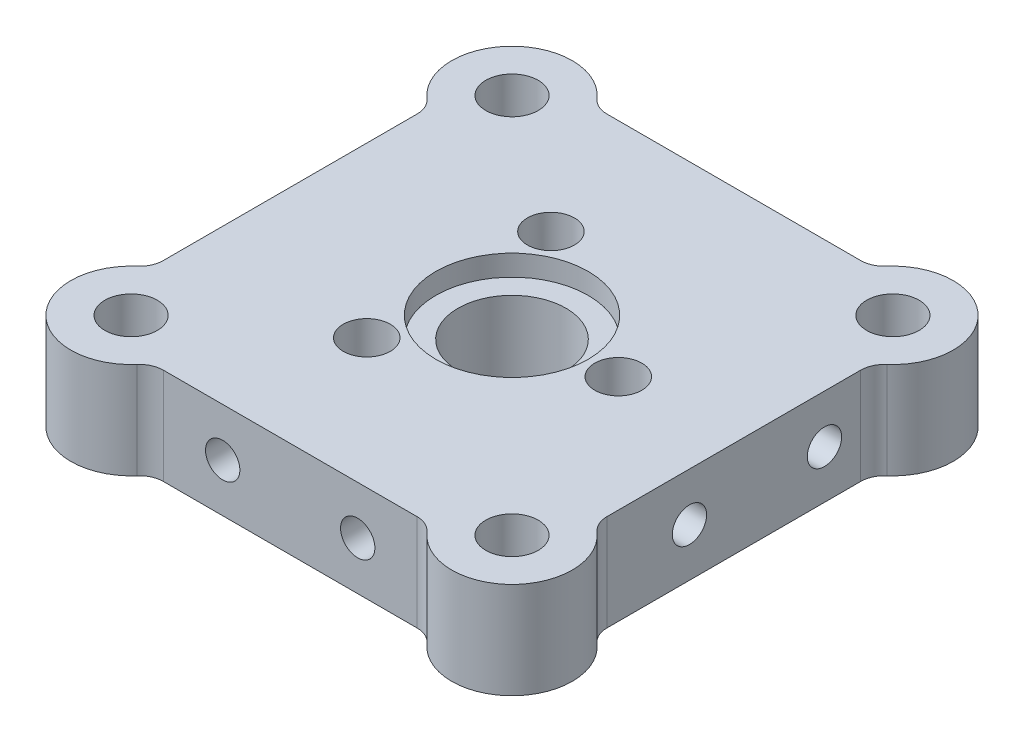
SolidWorks part; units mm, degrees
ref_plane "Front Plane" through (0, 0, 0) normal (0, 0, 1) x (1, 0, 0)
ref_plane "Top Plane" through (0, 0, 0) normal (0, 1, 0) x (1, 0, 0)
ref_plane "Right Plane" through (0, 0, 0) normal (1, 0, 0) x (0, 0, -1)
sketch "Sketch1" plane through (0, 0, 0) normal (0, 1, 0) x (0, 0, -1)
  line L0 (16.51, 16.51) -> (-16.51, -16.51) construction
  line L1 (16.51, 16.51) -> (-16.51, 16.51)
  line L2 (16.51, 12.5413) -> (16.51, -12.5413) construction
  line L3 (-16.51, -16.51) -> (16.51, -16.51)
  line L4 (16.51, 16.51) -> (16.51, -16.51)
  line L5 (-16.51, 16.51) -> (-16.51, -16.51)
  line L7 (12.5413, -16.51) -> (-12.5413, -16.51) construction
extrude "Extrude1" add sketch "Sketch1" along normal blind 6.35
sketch "Sketch3" plane through (0, 6.35, 0) normal (0, 1, 0) x (1, 0, 0)
  circle A0 centre (0, 0) radius 5.0165
  dimension "D1" = 10.033
extrude "Cut-Extrude2" cut sketch "Sketch3" against normal blind 1.3716
sketch "Sketch4" plane through (0, 4.9784, 0) normal (0, 1, 0) x (1, 0, 0)
  circle A0 centre (0, 0) radius 3.556
  dimension "D1" = 7.112
extrude "Cut-Extrude3" cut sketch "Sketch4" against normal up to next
fillet "Fillet1" radius 3.9688 4 edges at (16.51, 3.175, 16.51) (-16.51, 3.175, 16.51) (16.51, 3.175, -16.51) (-16.51, 3.175, -16.51)
sketch "Sketch21" plane through (0, 6.35, 0) normal (0, 1, 0) x (1, 0, 0)
  line L0 (16.51, -12.5412) -> (16.51, 12.5412)
  line L1 (12.5413, 16.51) -> (-12.5413, 16.51)
  line L2 (-16.51, 12.5412) -> (-16.51, -12.5412)
  line L3 (-12.5413, -16.51) -> (12.5413, -16.51)
  line L4 (-14.605, 0) -> (-16.51, 0) construction
  line L5 (14.605, 0) -> (16.51, 0) construction
  line L6 (0, 14.605) -> (0, 16.51) construction
  line L7 (0, -14.605) -> (0, -16.51) construction
  line L21 (8.3531, -14.605) -> (-8.3531, -14.605)
  line L22 (14.605, -8.3531) -> (14.605, 8.3531)
  line L23 (8.3531, 14.605) -> (-8.3531, 14.605)
  line L24 (-14.605, -8.3531) -> (-14.605, 8.3531)
  line L28 (-12.5413, -16.51) -> (12.5413, -16.51) construction
  arc A0 (16.51, -12.5412) -> (15.1493, -9.5497) centre (12.5413, -12.5412) ccw
  arc A1 (-12.5413, -16.51) -> (-9.5497, -15.1493) centre (-12.5413, -12.5412) ccw
  arc A2 (-16.51, 12.5412) -> (-15.1493, 9.5497) centre (-12.5413, 12.5412) ccw
  arc A3 (12.5413, 16.51) -> (9.5497, 15.1493) centre (12.5413, 12.5412) ccw
  arc A4 (15.1493, 9.5497) -> (14.605, 8.3531) centre (16.1925, 8.3531) ccw
  arc A5 (15.1493, -9.5497) -> (14.605, -8.3531) centre (16.1925, -8.3531) cw
  arc A6 (9.5497, -15.1493) -> (8.3531, -14.605) centre (8.3531, -16.1925) ccw
  arc A7 (-9.5497, -15.1493) -> (-8.3531, -14.605) centre (-8.3531, -16.1925) cw
  arc A8 (-15.1493, -9.5497) -> (-14.605, -8.3531) centre (-16.1925, -8.3531) ccw
  arc A9 (-15.1493, 9.5497) -> (-14.605, 8.3531) centre (-16.1925, 8.3531) cw
  arc A10 (-9.5497, 15.1493) -> (-8.3531, 14.605) centre (-8.3531, 16.1925) ccw
  arc A11 (9.5497, 15.1493) -> (8.3531, 14.605) centre (8.3531, 16.1925) cw
  arc A16 (9.5497, -15.1493) -> (12.5413, -16.51) centre (12.5413, -12.5412) ccw
  arc A17 (15.1493, 9.5497) -> (16.51, 12.5412) centre (12.5413, 12.5412) ccw
  arc A18 (-9.5497, 15.1493) -> (-12.5413, 16.51) centre (-12.5413, 12.5412) ccw
  arc A19 (-15.1493, -9.5497) -> (-16.51, -12.5412) centre (-12.5413, -12.5412) ccw
  arc A20 (12.5413, -16.51) -> (16.51, -12.5412) centre (12.5413, -12.5412) ccw construction
  arc A21 (16.51, 12.5412) -> (12.5413, 16.51) centre (12.5413, 12.5412) ccw construction
  arc A22 (-12.5413, 16.51) -> (-16.51, 12.5412) centre (-12.5413, 12.5412) ccw construction
  arc A23 (-16.51, -12.5412) -> (-12.5413, -16.51) centre (-12.5413, -12.5412) ccw construction
  dimension "D5" = 1.5875
  dimension "D4" = 1.905
extrude "Cut-Extrude4" cut sketch "Sketch21" against normal through all
hole_wizard "CBORE for M2.5 SHCS1" positions "Sketch6" profile "Sketch7" counterbore size "M2.5" standard "ANSI Metric"
sketch "Sketch6" plane through (3.175, 0, 0) normal (0, 1, 0) x (-1, 0, 0)
  circle A0 centre (-3.825, 0) radius 1.025 construction
  circle A1 centre (6.675, -6.0622) radius 1.025 construction
  circle A2 centre (6.675, 6.0622) radius 1.025 construction
  point P4 (-3.825, 0)
  point P10 (6.675, 6.0622)
  point P12 (6.675, -6.0622)
sketch "Sketch7" plane through (7, 0, 0) normal (1, 0, 0) x (0, 0, -1)
  line L0 (0, 0) -> (0, 6.35)
  line L1 (0, 6.35) -> (1.55, 6.35)
  line L3 (1.55, 6.35) -> (1.55, 3.516)
  line L4 (1.55, 3.516) -> (2.75, 3.516)
  line L5 (2.75, 3.516) -> (2.75, 0)
  line L7 (2.75, 0) -> (0, 0)
  line L11 (0, -6.35) -> (0, 107.95) construction
  dimension "Thru Hole Dia." = 3.1
  dimension "Thru Hole Depth" = 6.35
  dimension "C'Bore Dia." = 5.5
  dimension "C'Bore Depth" = 3.516
hole_wizard "#4-40 Tapped Hole1" positions "Sketch11" profile "Sketch12" tap size "#4-40" standard "ANSI Inch"
sketch "Sketch11" plane through (-14.605, 0, 0) normal (1, 0, 0) x (0, 0, -1)
  line L0 (-4.445, 3.175) -> (4.445, 3.175) construction
  line L10 (0, 0) -> (0, 6.35) construction
  line L12 (0, 3.175) -> (4.445, 3.175) construction
  line L14 (-8.3531, 6.35) -> (8.3531, 6.35) construction
  point P0 (-4.445, 3.175)
  point P2 (4.445, 3.175)
  dimension "D1" = 8.89
sketch "Sketch12" plane through (-14.605, 3.175, 4.445) normal (0, 1, 0) x (0, 0, 1)
  line L0 (0, 0) -> (0, 8.2738)
  line L1 (0, 8.2738) -> (1.1303, 7.5946)
  line L2 (1.1303, 7.5946) -> (1.1303, 0)
  line L5 (1.1303, 0) -> (0, 0)
  line L10 (0, 8.2738) -> (-1.1303, 7.5946) construction
  line L11 (0, -6.35) -> (0, 107.95) construction
  dimension "Tap Drill Dia." = 2.2606
  dimension "Tap Drill Depth" = 7.5946
  dimension "Drill Angle" = 118
hole_wizard "#4-40 Tapped Hole2" positions "Sketch13" profile "Sketch14" tap size "#4-40" standard "ANSI Inch"
sketch "Sketch13" plane through (0, 0, 14.605) normal (0, 0, -1) x (-1, 0, 0)
  line L1 (-4.445, 3.175) -> (4.445, 3.175) construction
  line L3 (0, 0) -> (0, 6.35) construction
  line L6 (-8.3531, 6.35) -> (8.3531, 6.35) construction
  line L7 (-8.3531, 0) -> (8.3531, 0) construction
  point P0 (4.445, 3.175)
  point P2 (-4.445, 3.175)
  point P34 (0, 3.175)
  dimension "D1" = 8.89
sketch "Sketch14" plane through (-4.445, 3.175, 14.605) normal (1, 0, 0) x (0, -1, 0)
  line L0 (0, 0) -> (0, 8.2738)
  line L1 (0, 8.2738) -> (1.1303, 7.5946)
  line L2 (1.1303, 7.5946) -> (1.1303, 0)
  line L5 (1.1303, 0) -> (0, 0)
  line L10 (0, 8.2738) -> (-1.1303, 7.5946) construction
  line L11 (0, -6.35) -> (0, 107.95) construction
  dimension "Tap Drill Dia." = 2.2606
  dimension "Tap Drill Depth" = 7.5946
  dimension "Drill Angle" = 118
hole_wizard "#8-32 Tapped Hole1" positions "Sketch15" profile "Sketch16" tap size "#8-32" standard "ANSI Inch"
sketch "Sketch15" plane through (0, 6.35, 0) normal (0, 1, 0) x (1, 0, 0)
  circle A3 centre (-12.5412, 12.5413) radius 1.5875 construction
  circle A4 centre (12.5413, 12.5413) radius 1.5875 construction
  circle A5 centre (12.5413, -12.5412) radius 1.5875 construction
  circle A6 centre (-12.5412, -12.5412) radius 1.5875 construction
  point P0 (12.5413, 12.5412)
  point P2 (-12.5412, 12.5412)
  point P116 (12.5413, -12.5413)
  point P119 (-12.5412, -12.5413)
sketch "Sketch16" plane through (12.5413, 6.35, -12.5412) normal (1, 0, 0) x (0, 0, 1)
  line L0 (0, 0) -> (0, 6.35)
  line L1 (0, 6.35) -> (1.7272, 6.35)
  line L2 (1.7272, 6.35) -> (1.7272, 0)
  line L5 (1.7272, 0) -> (0, 0)
  line L11 (0, -6.35) -> (0, 107.95) construction
  dimension "Thru Tap Drill Dia." = 3.4544
  dimension "Thru Tap Drill Depth" = 6.35
hole_wizard "#4-40 Tapped Hole3" positions "Sketch17" profile "Sketch18" tap size "#4-40" standard "ANSI Inch"
sketch "Sketch17" plane through (0, 0, -14.605) normal (0, 0, -1) x (-1, 0, 0)
  line L0 (-5.207, 3.175) -> (3.683, 3.175) construction
  line L1 (-0.762, 6.35) -> (-0.762, 0) construction
  line L7 (8.3531, 0) -> (-8.3531, 0) construction
  line L8 (8.3531, 6.35) -> (-8.3531, 6.35) construction
  point P0 (-5.207, 3.175)
  point P2 (3.683, 3.175)
  point P15 (-0.762, 3.175)
  dimension "D1" = 8.89
  dimension "D2" = 0.762
sketch "Sketch18" plane through (5.207, 3.175, -14.605) normal (1, 0, 0) x (0, 1, 0)
  line L0 (0, 0) -> (0, 8.2738)
  line L1 (0, 8.2738) -> (1.1303, 7.5946)
  line L2 (1.1303, 7.5946) -> (1.1303, 0)
  line L5 (1.1303, 0) -> (0, 0)
  line L10 (0, 8.2738) -> (-1.1303, 7.5946) construction
  line L11 (0, -6.35) -> (0, 107.95) construction
  dimension "Tap Drill Dia." = 2.2606
  dimension "Tap Drill Depth" = 7.5946
  dimension "Drill Angle" = 118
hole_wizard "#4-40 Tapped Hole4" positions "Sketch19" profile "Sketch20" tap size "#4-40" standard "ANSI Inch"
sketch "Sketch19" plane through (14.605, 0, 0) normal (1, 0, 0) x (0, 0, -1)
  line L0 (-2.921, 3.175) -> (5.969, 3.175) construction
  line L2 (1.524, 6.35) -> (1.524, 0) construction
  line L4 (-16.51, 0) -> (16.51, 0) construction
  line L5 (8.3531, 6.35) -> (-8.3531, 6.35) construction
  point P0 (5.969, 3.175)
  point P2 (-2.921, 3.175)
  point P17 (1.524, 3.175)
  dimension "D1" = 1.524
  dimension "D2" = 8.89
sketch "Sketch20" plane through (14.605, 3.175, -5.969) normal (0, 1, 0) x (0, 0, -1)
  line L0 (0, 0) -> (0, 8.2738)
  line L1 (0, 8.2738) -> (1.1303, 7.5946)
  line L2 (1.1303, 7.5946) -> (1.1303, 0)
  line L5 (1.1303, 0) -> (0, 0)
  line L10 (0, 8.2738) -> (-1.1303, 7.5946) construction
  line L11 (0, -6.35) -> (0, 107.95) construction
  dimension "Tap Drill Dia." = 2.2606
  dimension "Tap Drill Depth" = 7.5946
  dimension "Drill Angle" = 118
